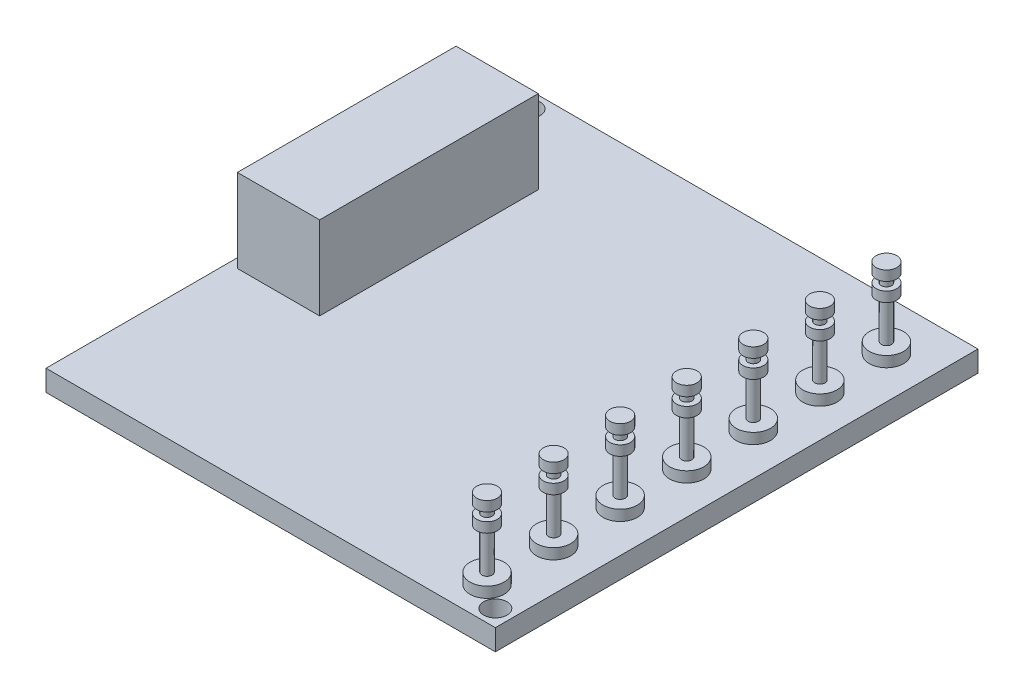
SolidWorks part; units mm, degrees
ref_plane "Front Plane" through (0, 0, 0) normal (0, 0, 1) x (1, 0, 0)
ref_plane "Top Plane" through (0, 0, 0) normal (0, 1, 0) x (1, 0, 0)
ref_plane "Right Plane" through (0, 0, 0) normal (1, 0, 0) x (0, 0, -1)
sketch "Sketch1" plane through (0, 0, 0) normal (0, 1, 0) x (1, 0, 0)
  line L1 (-17.145, -18.415) -> (17.145, -18.415)
  line L2 (-17.145, -18.415) -> (-17.145, 18.415)
  line L3 (-17.145, 18.415) -> (17.145, 18.415)
  line L4 (17.145, -18.415) -> (17.145, 18.415)
  line L5 (-17.145, -18.415) -> (17.145, 18.415) construction
  line L6 (-17.145, 18.415) -> (17.145, -18.415) construction
  point P0 (0, 0)
  dimension "D1" = 34.29
  dimension "D2" = 36.83
extrude "Boss-Extrude1" add sketch "Sketch1" along normal blind 1.6002
sketch "Sketch2" plane through (0, 1.6002, 0) normal (0, 1, 0) x (1, 0, 0)
  line L0 (17.145, 18.415) -> (-17.145, 18.415) construction
  line L1 (-16.4338, 12.1666) -> (-10.16, 12.1666)
  line L2 (-16.4338, 12.1666) -> (-16.4338, -4.5212)
  line L3 (-16.4338, -4.5212) -> (-10.16, -4.5212)
  line L4 (-10.16, 12.1666) -> (-10.16, -4.5212)
  line L5 (-17.145, 18.415) -> (-17.145, -18.415) construction
  dimension "D1" = 16.6878
  dimension "D2" = 6.2738
  dimension "D3" = 6.2484
  dimension "D4" = 0.7112
extrude "Boss-Extrude2" add sketch "Sketch2" along normal blind 6.35
sketch "Sketch3" plane through (0, 0, 0) normal (0, -1, 0) x (1, 0, 0)
  circle A0 centre (-10.6274, -5.9905) radius 0.3277
  dimension "D1" = 0.6553
extrude "Boss-Extrude3" add sketch "Sketch3" along normal blind 1.4732
hole_wizard "#50 (0.07) Diameter Hole1" positions "Sketch4" profile "Sketch5" hole size "#50" standard "ANSI Inch"
sketch "Sketch4" plane through (0, 1.6002, 0) normal (0, 1, 0) x (1, 0, 0)
  line L2 (-17.145, 18.415) -> (-17.145, -18.415) construction
  line L5 (17.145, 18.415) -> (-17.145, 18.415) construction
  point P0 (-15.875, 17.145)
  point P2 (15.875, -17.145)
  dimension "D1" = 1.27
  dimension "D2" = 31.75
  dimension "D3" = 1.27
  dimension "D4" = 34.29
sketch "Sketch5" plane through (-15.875, 1.6002, -17.145) normal (1, 0, 0) x (0, 0, 1)
  line L0 (0, 0) -> (0, 3.0734)
  line L1 (0, 3.0734) -> (0.889, 3.0734)
  line L2 (0.889, 3.0734) -> (0.889, 0)
  line L5 (0.889, 0) -> (0, 0)
  line L11 (0, -6.35) -> (0, 107.95) construction
  dimension "Thru Hole Dia." = 1.778
  dimension "Thru Hole Depth" = 3.0734
ref_plane "Plane1" through (13.97, 0, 0) normal (1, 0, 0) x (0, 0, -1)
sketch "Sketch6" plane through (13.97, 0, 0) normal (1, 0, 0) x (0, 0, -1)
  line L0 (-15.875, 1.6002) -> (-15.875, 11.3077) construction
  line L1 (-15.875, 1.6002) -> (-17.1831, 1.6002)
  line L2 (-17.1831, 1.6002) -> (-17.1831, 2.413)
  line L3 (-17.1831, 2.413) -> (-16.2687, 2.413)
  line L4 (-16.2687, 2.413) -> (-16.2687, 5.5372)
  line L5 (-16.2687, 5.5372) -> (-16.6624, 5.5372)
  line L6 (-16.6624, 5.5372) -> (-16.6624, 6.2992)
  line L7 (-16.6624, 6.2992) -> (-16.2687, 6.2992)
  line L8 (-16.2687, 6.2992) -> (-16.2687, 6.9342)
  line L9 (-16.2687, 6.9342) -> (-16.6624, 6.9342)
  line L10 (-16.6624, 6.9342) -> (-16.6624, 7.6962)
  line L11 (-16.6624, 7.6962) -> (-15.875, 7.6962)
  line L12 (-15.875, 7.6962) -> (-15.875, 1.6002)
  line L13 (-18.415, 1.6002) -> (18.415, 1.6002) construction
  line L14 (-18.415, 1.6002) -> (-18.415, 0) construction
  dimension "D1" = 6.096
  dimension "D2" = 0.762
  dimension "D3" = 0.635
  dimension "D4" = 0.8128
  dimension "D5" = 0.7874
  dimension "D6" = 2.6162
  dimension "D7" = 1.5748
  dimension "D8" = 2.54
revolve "Revolve1" add sketch "Sketch6" angle 360 about L0
pattern_linear "LPattern1" count 7 spacing 5.08 along (0, 0, -1) of "Revolve1"
sketch "Sketch7" plane through (0, 1.6002, 0) normal (0, 1, 0) x (1, 0, 0)
  line L0 (-15.875, 17.145) -> (15.875, -17.145) construction
  line L1 (17.145, -18.415) -> (17.145, 18.415) construction
  line L2 (-17.145, -18.415) -> (17.145, -18.415) construction
  dimension "D1" = 42.797
  dimension "D2" = 47.203
